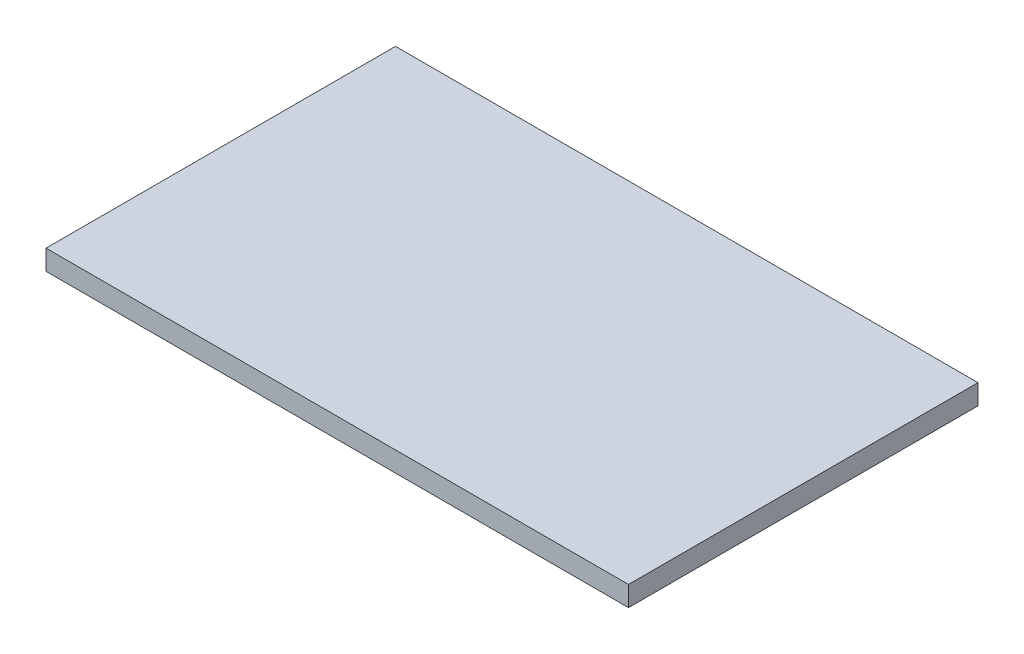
SolidWorks part; units mm, degrees
ref_plane "Front Plane" through (0, 0, 0) normal (0, 0, 1) x (1, 0, 0)
ref_plane "Top Plane" through (0, 0, 0) normal (0, 1, 0) x (1, 0, 0)
ref_plane "Right Plane" through (0, 0, 0) normal (1, 0, 0) x (0, 0, -1)
sketch "Sketch1" plane through (0, 0, 0) normal (0, 1, 0) x (1, 0, 0)
  line L1 (0, 0) -> (254, 0)
  line L2 (0, 0) -> (0, 152.4)
  line L3 (0, 152.4) -> (254, 152.4)
  line L4 (254, 0) -> (254, 152.4)
  dimension "D1" = 152.4
  dimension "D2" = 254
extrude "Boss-Extrude1" add sketch "Sketch1" along normal blind 8.763
